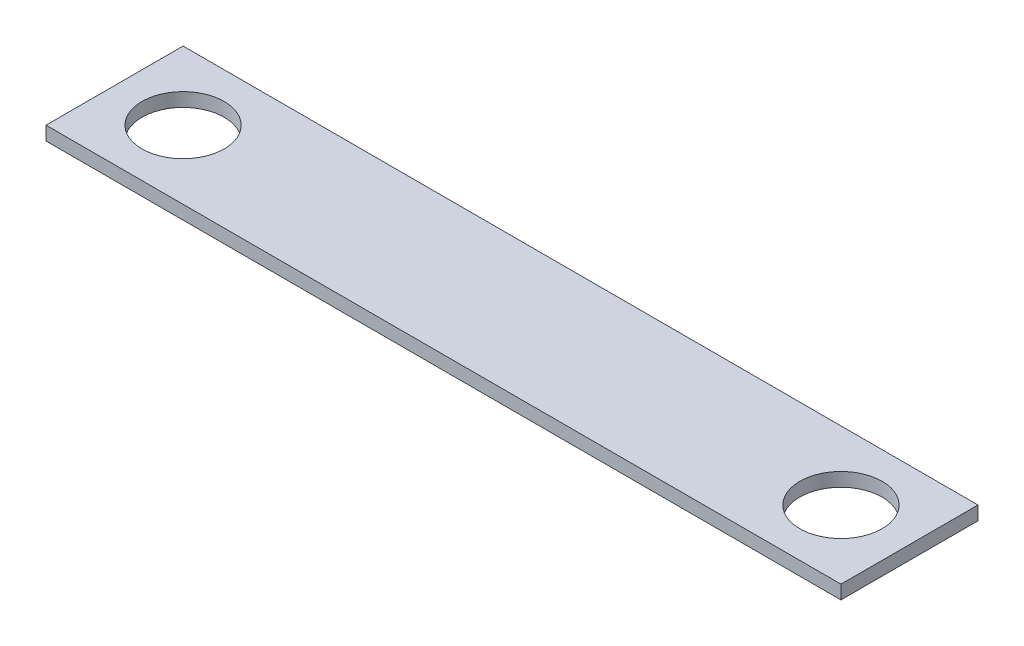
SolidWorks part; units mm, degrees
ref_plane "Спереди" through (0, 0, 0) normal (0, 0, 1) x (1, 0, 0)
ref_plane "Сверху" through (0, 0, 0) normal (0, 1, 0) x (1, 0, 0)
ref_plane "Справа" through (0, 0, 0) normal (1, 0, 0) x (0, 0, -1)
sketch "Эскиз1" plane through (0, 0, 0) normal (0, 1, 0) x (1, 0, 0)
  line L1 (0, 0) -> (29, 0)
  line L2 (0, 0) -> (0, 5)
  line L3 (0, 5) -> (29, 5)
  line L4 (29, 0) -> (29, 5)
  dimension "D1" = 5
  dimension "D2" = 29
extrude "Бобышка-Вытянуть1" add sketch "Эскиз1" along normal blind 0.5
sketch "Эскиз2" plane through (0, 0.5, 0) normal (0, 1, 0) x (1, 0, 0)
  line L0 (14.5, 5) -> (14.5, -0.7579) construction
  line L1 (29, 5) -> (0, 5) construction
  line L2 (0, 2.5) -> (29, 2.5) construction
  line L3 (0, 5) -> (0, 0) construction
  line L4 (29, 0) -> (29, 5) construction
  circle A0 centre (2.5, 2.5) radius 1.5
  circle A1 centre (26.5, 2.5) radius 1.5
  dimension "D1" = 3
  dimension "D2" = 24
extrude "Вырез-Вытянуть1" cut sketch "Эскиз2" against normal through all
